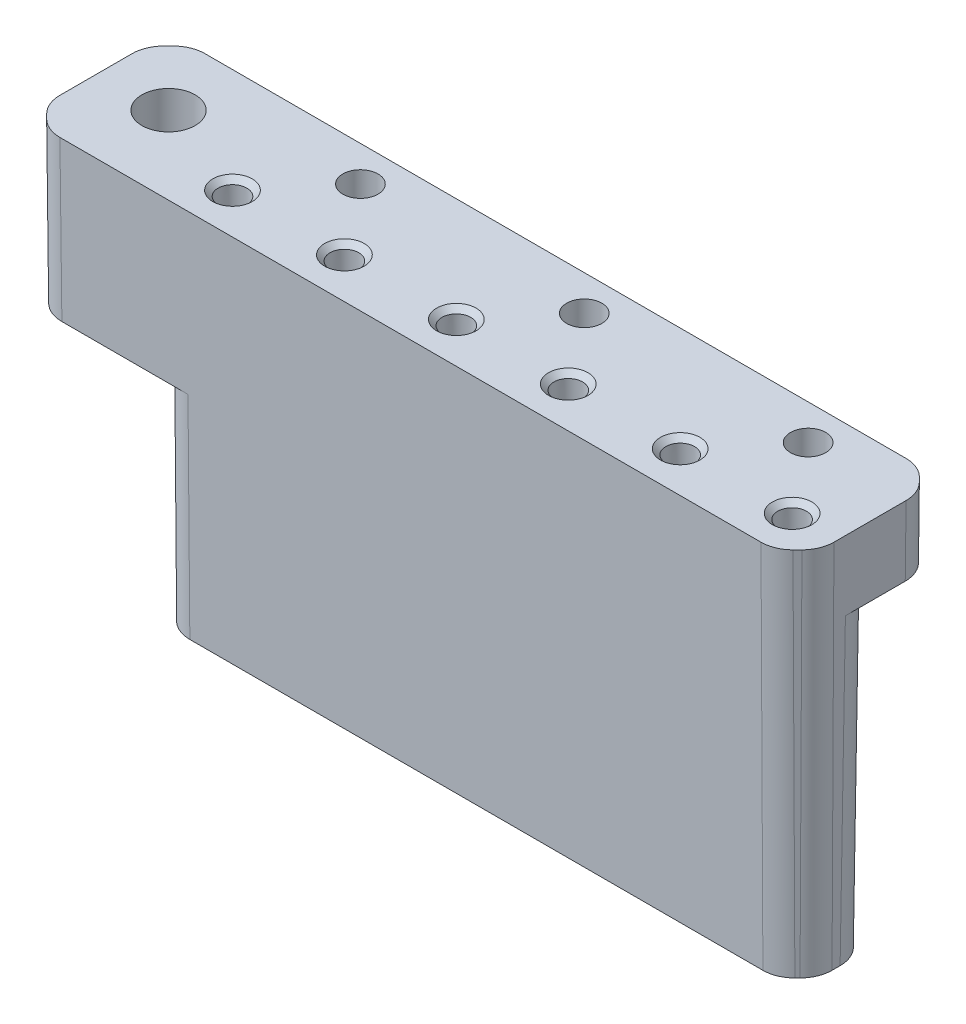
SolidWorks part; units mm, degrees
ref_plane "Plan de face" through (0, 0, 0) normal (0, 0, 1) x (1, 0, 0)
ref_plane "Plan de dessus" through (0, 0, 0) normal (0, 1, 0) x (1, 0, 0)
ref_plane "Plan de droite" through (0, 0, 0) normal (1, 0, 0) x (0, 0, -1)
sketch "Esquisse1" plane through (0, 0, 0) normal (0, 0, 1) x (1, 0, 0)
  line L1 (0, 0) -> (72, 0)
  line L2 (0, 0) -> (0, 35)
  line L3 (0, 35) -> (72, 35)
  line L4 (72, 0) -> (72, 35)
  dimension "D1" = 72
  dimension "D2" = 35
extrude "Extrusion1" add sketch "Esquisse1" along normal blind 13
hole_wizard "Trou taraudé M63" positions "Esquisse3D3" profile "Esquisse7" tap size "M6" standard "ISO"
sketch3d "Esquisse3D3"
  line L0 (0, 35, 13) -> (0, 35, 0) construction
  line L1 (72, 35, 13) -> (0, 35, 13) construction
  point P1 (6, 35, 6)
  dimension "D1" = 6
  dimension "D2" = 7
sketch "Esquisse7" plane through (6, 35, 6) normal (1, 0, 0) x (0, 0, 1)
  line L0 (0, 0) -> (0, 21.5022)
  line L1 (0, 21.5022) -> (2.5, 20)
  line L2 (2.5, 20) -> (2.5, 0)
  line L5 (2.5, 0) -> (0, 0)
  line L10 (0, 21.5022) -> (-2.5, 20) construction
  line L11 (0, -6.35) -> (0, 107.95) construction
  dimension "Diamètre du trou pour taraudage" = 5
  dimension "Profondeur du trou pour taraudage" = 20
  dimension "Angle de pointe" = 118
hole_wizard "Trou taraudé M41" positions "Esquisse9" profile "Esquisse8" tap size "M4" standard "ISO"
sketch "Esquisse9" plane through (0, 35, 0) normal (0, 1, 0) x (-1, 0, 0)
  line L0 (0, 13) -> (0, 0) construction
  line L3 (-72, 0) -> (0, 0) construction
  point P0 (-21, 3)
  dimension "D1" = 21
  dimension "D2" = 3
sketch "Esquisse8" plane through (21, 35, 3) normal (1, 0, 0) x (0, 0, 1)
  line L0 (0, 0) -> (0, 16.4914)
  line L1 (0, 16.4914) -> (1.65, 15.5)
  line L2 (1.65, 15.5) -> (1.65, 0)
  line L5 (1.65, 0) -> (0, 0)
  line L10 (0, 16.4914) -> (-1.65, 15.5) construction
  line L11 (0, -6.35) -> (0, 107.95) construction
  dimension "Diamètre du trou pour taraudage" = 3.3
  dimension "Profondeur du trou pour taraudage" = 15.5
  dimension "Angle de pointe" = 118
pattern_linear "Répétition linéaire1" count 3 spacing 21 along (1, 0, 0) of "Trou taraudé M41"
hole_wizard "Diamètre du perçage Ø4.8 (4.8)2" positions "Esquisse15" profile "Esquisse14" hole size "Ø4.8" standard "ISO"
sketch "Esquisse15" plane through (0, 0, 0) normal (0, -1, 0) x (1, 0, 0)
  line L4 (72, 13) -> (72, 0) construction
  line L7 (0, 13) -> (72, 13) construction
  point P0 (68, 9.5)
  dimension "D1" = 4
  dimension "D2" = 3.5
sketch "Esquisse14" plane through (68, 0, 9.5) normal (1, 0, 0) x (0, 0, -1)
  line L0 (0, 0) -> (0, 23.4421)
  line L1 (0, 23.4421) -> (2.4, 22)
  line L2 (2.4, 22) -> (2.4, 0)
  line L5 (2.4, 0) -> (0, 0)
  line L10 (0, 23.4421) -> (-2.4, 22) construction
  line L11 (0, -6.35) -> (0, 107.95) construction
  dimension "Diamètre du perçage" = 4.8
  dimension "Profondeur du perçage" = 22
  dimension "Angle de pointe" = 118
pattern_linear "Répétition linéaire2" count 6 spacing 10.5 along (-1, 0, 0) of "Diamètre du perçage Ø4.8 (4.8)2"
hole_wizard "Diamètre du perçage Ø1.5 (1.5)3" positions "Esquisse3D4" profile "Esquisse20" hole size "Ø1.5" standard "ISO"
sketch3d "Esquisse3D4"
  line L0 (72, 0, 13) -> (72, 0, 0) construction
  line L2 (0, 0, 13) -> (72, 0, 13) construction
  point P0 (63, 0, 9)
  dimension "D1" = 9
  dimension "D2" = 4
sketch "Esquisse20" plane through (63, 0, 9) normal (1, 0, 0) x (0, 0, -1)
  line L0 (0, 0) -> (0, 10.4506)
  line L1 (0, 10.4506) -> (0.75, 10)
  line L2 (0.75, 10) -> (0.75, 0)
  line L5 (0.75, 0) -> (0, 0)
  line L10 (0, 10.4506) -> (-0.75, 10) construction
  line L11 (0, -6.35) -> (0, 107.95) construction
  dimension "Diamètre du perçage" = 1.5
  dimension "Profondeur du perçage" = 10
  dimension "Angle de pointe" = 118
pattern_linear "Répétition linéaire4" count 5 spacing 10.5 along (-1, 0, 0) of "Diamètre du perçage Ø1.5 (1.5)3"
hole_wizard "Diamètre du perçage Ø3.3 (3.3)1" positions "Esquisse22" profile "Esquisse21" hole size "Ø3.3" standard "ISO"
sketch "Esquisse22" plane through (0, 35, 0) normal (0, 1, 0) x (-1, 0, 0)
  line L2 (-72, 13) -> (-72, 0) construction
  line L3 (-72, 13) -> (0, 13) construction
  point P0 (-68, 9.5)
  dimension "D1" = 3.5
  dimension "D2" = 4
sketch "Esquisse21" plane through (68, 35, 9.5) normal (1, 0, 0) x (0, 0, 1)
  line L0 (0, 0) -> (0, 35)
  line L1 (0, 35) -> (1.65, 35)
  line L2 (1.65, 35) -> (1.65, 0)
  line L5 (1.65, 0) -> (0, 0)
  line L11 (0, -6.35) -> (0, 107.95) construction
  dimension "Diamètre du perçage jusqu'au prochain" = 3.3
  dimension "Profondeur du perçage jusqu'au prochain" = 35
pattern_linear "Répétition linéaire5" count 6 spacing 10.5 along (-1, 0, 0) of "Diamètre du perçage Ø3.3 (3.3)1"
chamfer "Chanfrein3" distance 0.7 angle 60 5 edges at (21, 0, 8.25) (31.5, 0, 8.25) (42, 0, 8.25) (52.5, 0, 8.25) (63, 0, 8.25)
chamfer "Chanfrein4" distance 2 angle 45 2 edges at (72, 17.5, 13) (0, 17.5, 13)
chamfer "Chanfrein6" distance 0.2 angle 45 6 edges at (68, 35, 11.15) (57.5, 35, 11.15) (47, 35, 11.15) (36.5, 35, 11.15) (26, 35, 11.15) (15.5, 35, 11.15)
chamfer "Chanfrein7" distance 0.2 angle 45 6 edges at (68, 0, 7.1) (57.5, 0, 7.1) (47, 0, 7.1) (36.5, 0, 7.1) (26, 0, 7.1) (15.5, 0, 7.1)
sketch "Esquisse26" plane through (0, 0, 0) normal (0, 0, -1) x (-1, 0, 0)
  line L0 (-72, 0) -> (-72, 35) construction
  line L1 (-73.6006, -4.4572) -> (-10, -4.4572)
  line L2 (-73.6006, -4.4572) -> (-73.6006, 28.4279)
  line L3 (-73.6006, 28.4279) -> (-10, 28.4279)
  line L4 (-10, -4.4572) -> (-10, 28.4279)
  dimension "D1" = 62
extrude "Enlèv. mat.-Extru.1" cut sketch "Esquisse26" against normal blind 6
sketch "Esquisse29" plane through (0, 0, 0) normal (0, 0, -1) x (-1, 0, 0)
  line L0 (-10, 0) -> (-72, 0) construction
  line L1 (-12, 20) -> (4.6268, 20)
  line L2 (-12, 20) -> (-12, 0)
  line L3 (-12, 0) -> (4.6268, 0)
  line L4 (4.6268, 20) -> (4.6268, 0)
  line L5 (0, 35) -> (0, 0) construction
  dimension "D1" = 20
  dimension "D2" = 20
  dimension "D3" = 12
extrude "Enlèv. mat.-Extru.3" cut sketch "Esquisse29" against normal through all
draft "Dépouille1" type of draft neutral plane draft angle 0.5 faces to draft 22 parameters "D1"=0.5
fillet "Congé1" radius 3 11 edges at (70.1146, 31.7139, -0.2768) (72.2768, 31.7139, 1.8854) (72.124, 14.2139, 5.876) (72.1527, 17.5, 11.0633) (70.0633, 17.5, 13.1527) (12, 10, 13.0873) (12, 10, 5.9127) (1.9006, 27.5, 13.24) (-0.24, 27.5, 11.0994) (-0.24, 27.5, 1.9006) (1.9006, 27.5, -0.24)
